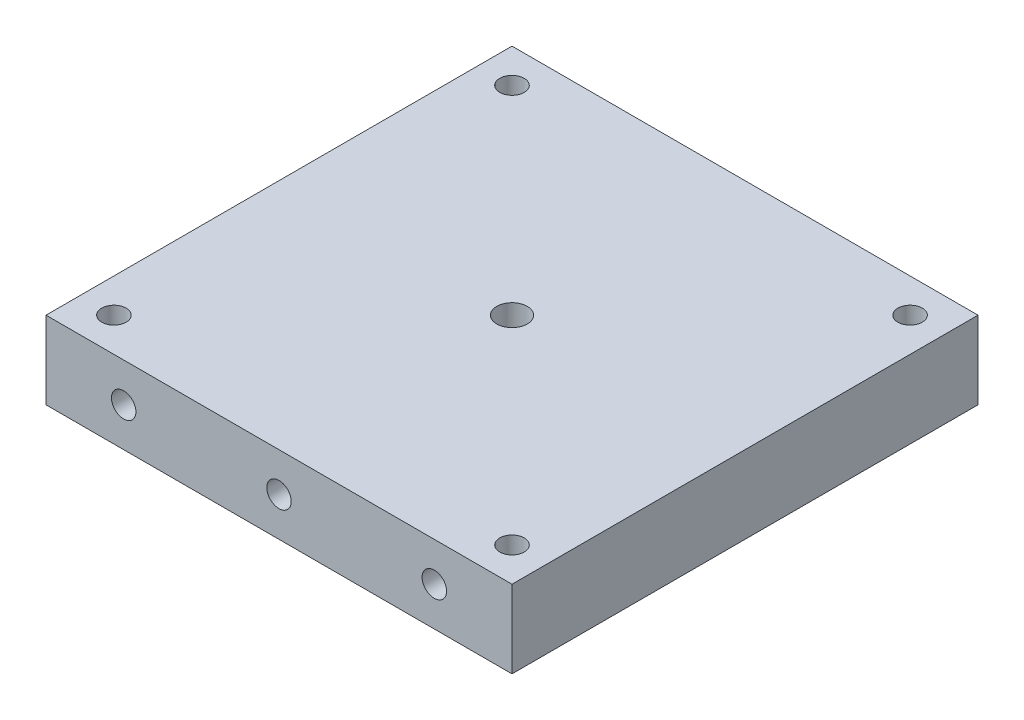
SolidWorks part; units mm, degrees
ref_plane "Front Plane" through (0, 0, 0) normal (0, 0, 1) x (1, 0, 0)
ref_plane "Top Plane" through (0, 0, 0) normal (0, 1, 0) x (1, 0, 0)
ref_plane "Right Plane" through (0, 0, 0) normal (1, 0, 0) x (0, 0, -1)
sketch "Sketch1" plane through (0, 0, 0) normal (0, 1, 0) x (1, 0, 0)
  line L1 (-64.553, 17.4419) -> (11.647, 17.4419)
  line L2 (-64.553, 17.4419) -> (-64.553, -58.7581)
  line L3 (-64.553, -58.7581) -> (11.647, -58.7581)
  line L4 (11.647, 17.4419) -> (11.647, -58.7581)
  dimension "D1" = 76.2
  dimension "D2" = 76.2
extrude "Boss-Extrude1" add sketch "Sketch1" along normal blind 12.7
sketch "Sketch2" plane through (0, 12.7, 0) normal (0, 1, 0) x (1, 0, 0)
  line L0 (11.647, -58.7581) -> (11.647, 17.4419) construction
  line L2 (11.647, 17.4419) -> (-64.553, 17.4419) construction
  point P0 (-26.453, -20.6581)
  dimension "D1" = 38.1
  dimension "D2" = 38.1
hole_wizard "Ø5.0 (5) Diameter Hole1" positions "3DSketch1" profile "Sketch4" hole size "Ø5.0" standard "Ansi Metric"
sketch3d "3DSketch1"
  point P0 (-26.453, 12.7, 20.6581)
sketch "Sketch4" plane through (-26.453, 12.7, 20.6581) normal (1, 0, 0) x (0, 0, 1)
  line L0 (0, 0) -> (0, 12.7)
  line L1 (0, 12.7) -> (2.5, 12.7)
  line L2 (2.5, 12.7) -> (2.5, 0)
  line L5 (2.5, 0) -> (0, 0)
  line L11 (0, -6.35) -> (0, 107.95) construction
  dimension "Thru Hole Dia." = 5
  dimension "Thru Hole Depth" = 12.7
sketch "Sketch5" plane through (0, 0, 58.7581) normal (0, 0, 1) x (1, 0, 0)
  line L0 (-64.553, 12.7) -> (-64.553, 0) construction
  line L1 (-64.553, 0) -> (11.647, 0) construction
  line L3 (11.647, 12.7) -> (11.647, 0) construction
  circle A0 centre (-51.853, 6.35) radius 2
  circle A1 centre (-26.453, 6.35) radius 2
  circle A2 centre (-1.053, 6.35) radius 2
  point P10 (11.647, 6.35)
  dimension "D7" = 4
  dimension "D8" = 4
  dimension "D9" = 4
  dimension "D1" = 12.7
  dimension "D2" = 6.35
  dimension "D3" = 6.35
  dimension "D4" = 6.35
  dimension "D5" = 12.7
  dimension "D6" = 38.1
extrude "Cut-Extrude1" cut sketch "Sketch5" against normal blind 25.4
sketch "Sketch6" plane through (0, 12.7, 0) normal (0, 1, 0) x (-1, 0, 0)
  line L0 (-11.647, -17.4419) -> (64.553, -17.4419) construction
  line L1 (64.553, -17.4419) -> (64.553, 58.7581) construction
  line L4 (64.553, 58.7581) -> (-11.647, 58.7581) construction
  line L5 (-11.647, 58.7581) -> (-11.647, -17.4419) construction
  point P0 (58.9968, -11.8857)
  point P1 (58.9968, 53.2018)
  point P2 (-6.0907, 53.2018)
  point P3 (-6.0907, -11.8857)
  dimension "D1" = 5.5562
  dimension "D2" = 5.5562
  dimension "D3" = 5.5562
  dimension "D4" = 5.5562
  dimension "D5" = 5.5562
  dimension "D6" = 5.5562
  dimension "D7" = 5.5562
  dimension "D8" = 5.5562
hole_wizard "Ø4.0 (4) Diameter Hole1" positions "3DSketch2" profile "Sketch7" hole size "Ø4.0" standard "Ansi Metric"
sketch3d "3DSketch2"
  point P0 (-58.9968, 12.7, -11.8857)
  point P3 (6.0907, 12.7, -11.8857)
  point P6 (6.0907, 12.7, 53.2018)
  point P9 (-58.9968, 12.7, 53.2018)
sketch "Sketch7" plane through (-58.9968, 12.7, -11.8857) normal (1, 0, 0) x (0, 0, 1)
  line L0 (0, 0) -> (0, 7.5517)
  line L1 (0, 7.5517) -> (2, 6.35)
  line L2 (2, 6.35) -> (2, 0)
  line L5 (2, 0) -> (0, 0)
  line L10 (0, 7.5517) -> (-2, 6.35) construction
  line L11 (0, -6.35) -> (0, 107.95) construction
  dimension "Hole Dia." = 4
  dimension "Hole Depth" = 6.35
  dimension "Drill Angle" = 118
